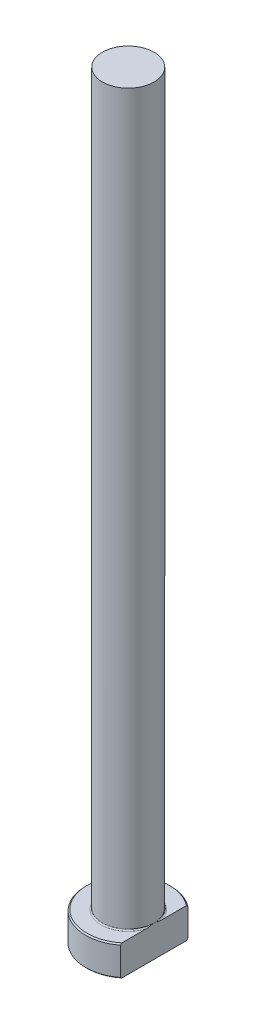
SolidWorks part; units mm, degrees
ref_plane "Front Plane" through (0, 0, 0) normal (0, 0, 1) x (1, 0, 0)
ref_plane "Top Plane" through (0, 0, 0) normal (0, 1, 0) x (1, 0, 0)
ref_plane "Right Plane" through (0, 0, 0) normal (1, 0, 0) x (0, 0, -1)
sketch "Sketch1" plane through (0, 0, 0) normal (0, 0, 1) x (1, 0, 0)
  line L0 (0, 259.9588) -> (0, -15.1925) construction
  line L1 (0, 0) -> (-7, 0)
  line L2 (-7, 0) -> (-7, 5)
  line L3 (-7, 5) -> (-4.25, 5)
  line L4 (-4.25, 5) -> (-4.25, 125)
  line L5 (-4.25, 125) -> (0, 125)
  line L6 (0, 125) -> (0, 0)
  dimension "L" = 125
  dimension "H" = 14
  dimension "T" = 5
  dimension "D" = 8.5
revolve "Revolve1" add sketch "Sketch1" angle 360 about L0
chamfer "Chamfer1" distance 0.2 angle 45 2 edges at (0, 5, 7) (0, 0, 7)
fillet "Fillet1" radius 0.2 1 edges at (0, 5, 4.25)
sketch "Sketch2" plane through (0, 0, 0) normal (0, 1, 0) x (1, 0, 0)
  line L0 (4.25, 5.5621) -> (4.25, -5.5621)
  circle A0 centre (0, 0) radius 7 construction
  arc A1 (4.25, -5.5621) -> (4.25, 5.5621) centre (0, 0) ccw
  circle A2 centre (0, 0) radius 4.25 construction
extrude "KEY" cut sketch "Sketch2" along normal through all
